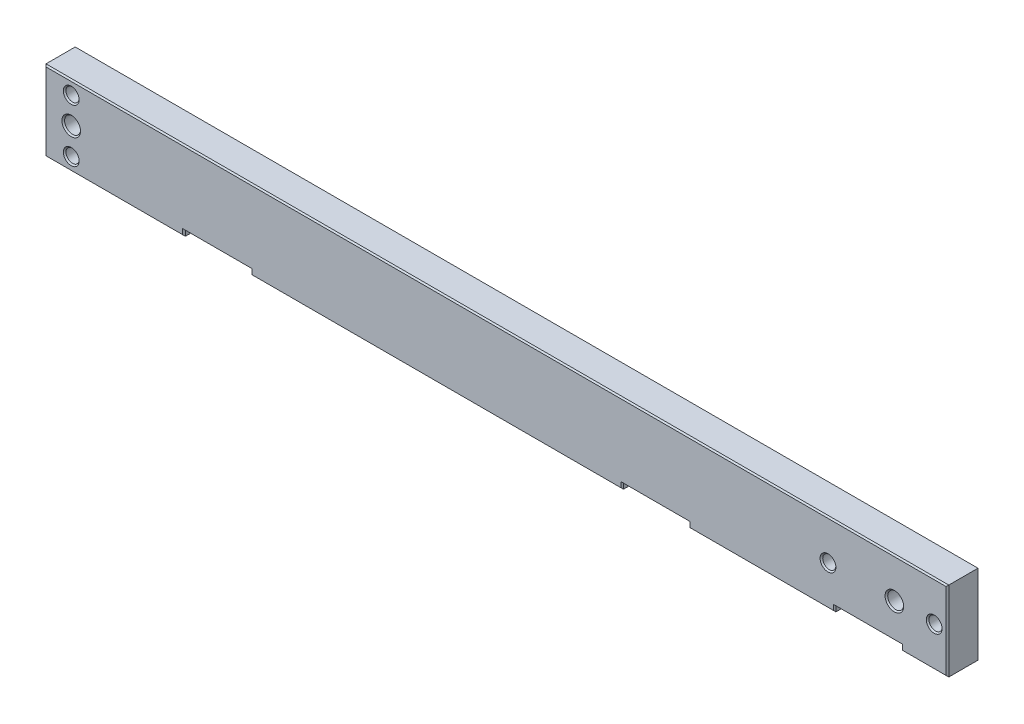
SolidWorks part; units mm, degrees
ref_plane "Plane1" through (0, 0, 0) normal (0, 0, 1) x (1, 0, 0)
ref_plane "Plane2" through (0, 0, 0) normal (0, 1, 0) x (1, 0, 0)
ref_plane "Plane3" through (0, 0, 0) normal (1, 0, 0) x (0, 0, -1)
sketch "Esquisse1" plane through (0, 0, 0) normal (0, 0, 1) x (1, 0, 0)
  line L0 (0, 0) -> (0, 30)
  line L1 (0, 30) -> (340, 30)
  line L2 (340, 30) -> (340, 0)
  line L3 (340, 0) -> (322.5, 0)
  line L4 (322.5, 0) -> (322.5, 2)
  line L5 (322.5, 2) -> (297.5, 2)
  line L6 (297.5, 2) -> (297.5, 0)
  line L7 (297.5, 0) -> (242.5, 0)
  line L8 (242.5, 0) -> (242.5, 2)
  line L9 (242.5, 2) -> (217.5, 2)
  line L10 (217.5, 2) -> (217.5, 0)
  line L11 (217.5, 0) -> (77.5, 0)
  line L12 (77.5, 0) -> (77.5, 2)
  line L13 (77.5, 2) -> (52.5, 2)
  line L14 (52.5, 2) -> (52.5, 0)
  line L15 (52.5, 0) -> (0, 0)
  circle A0 centre (335, 15) radius 2.475
  circle A1 centre (295, 15) radius 2.475
  circle A2 centre (320, 15) radius 3
  circle A3 centre (10, 25) radius 2.475
  circle A4 centre (10, 15) radius 3
  circle A5 centre (10, 5) radius 2.475
  dimension "D13" = 4.95
  dimension "D14" = 6
  dimension "D15" = 4.95
  dimension "D22" = 6
  dimension "D23" = 4.95
  dimension "D24" = 4.95
  dimension "D1" = 30
  dimension "D2" = 340
  dimension "D3" = 52.5
  dimension "D4" = 217.5
  dimension "D5" = 297.5
  dimension "D6" = 25
  dimension "D7" = 25
  dimension "D8" = 25
  dimension "D9" = 2
  dimension "D10" = 2
  dimension "D11" = 55
  dimension "D12" = 2
  dimension "D16" = 5
  dimension "D17" = 15
  dimension "D18" = 25
  dimension "D19" = 10
  dimension "D20" = 10
  dimension "D21" = 10
  dimension "D25" = 15
  dimension "D26" = 15
  dimension "D27" = 15
  dimension "D28" = 5
  dimension "D29" = 45
  dimension "D30" = 20
extrude "Base-Extrusion" add sketch "Esquisse1" along normal blind 12
sketch "Esquisse2" plane through (0, 0, 0) normal (0, 1, 0) x (1, 0, 0)
  line L0 (0, -12) -> (0, 0) construction
  line L1 (77.5, -12) -> (52.5, -12) construction
  line L2 (242.5, -12) -> (217.5, -12) construction
  line L3 (322.5, -12) -> (297.5, -12) construction
  circle A0 centre (65, -6) radius 4
  circle A1 centre (230, -6) radius 4
  circle A2 centre (310, -6) radius 4
  dimension "D1" = 8
  dimension "D4" = 8
  dimension "D7" = 8
  dimension "D2" = 65
  dimension "D3" = 6
  dimension "D5" = 6
  dimension "D6" = 230
  dimension "D8" = 6
  dimension "D9" = 310
extrude "Enlèv. mat.-Extru.2" cut sketch "Esquisse2" along normal blind 22
chamfer "Chanfrein1" distance 0.5 angle 45
chamfer "Chanfrein2" distance 0.5 angle 45
chamfer "Chanfrein3" distance 0.5 angle 45
chamfer "Chanfrein4" distance 0.5 angle 45
chamfer "Chanfrein5" distance 0.5 angle 45
